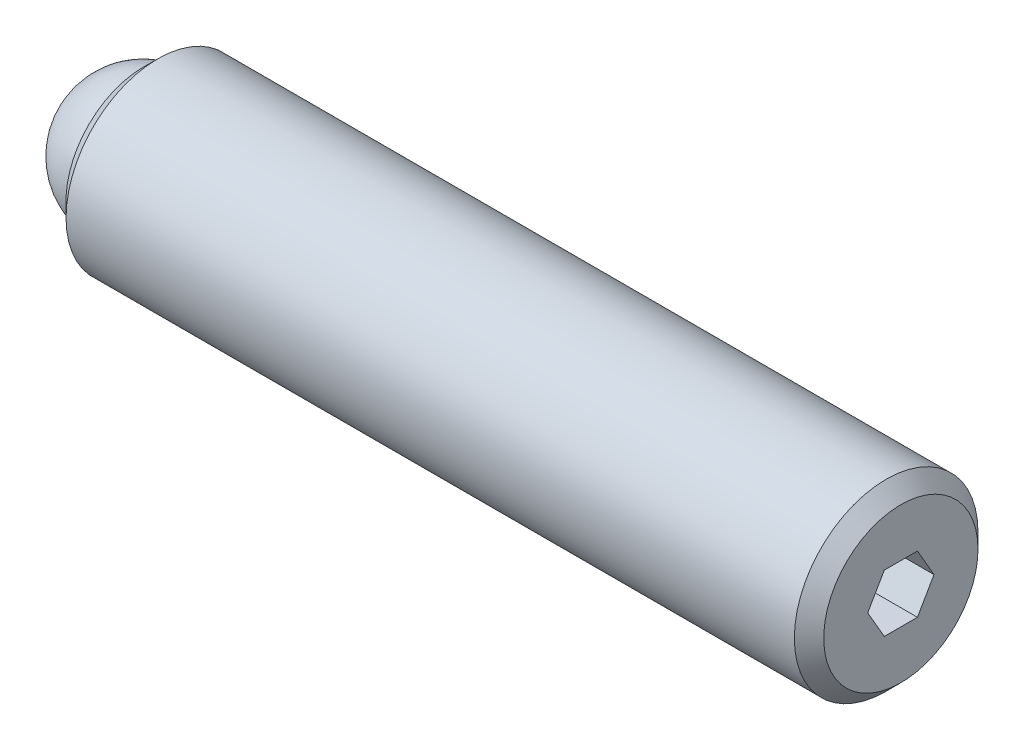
SolidWorks part; units mm, degrees
ref_plane "Front Plane" through (0, 0, 0) normal (0, 0, 1) x (1, 0, 0)
ref_plane "Top Plane" through (0, 0, 0) normal (0, 1, 0) x (1, 0, 0)
ref_plane "Right Plane" through (0, 0, 0) normal (1, 0, 0) x (0, 0, -1)
sketch "Sketch2" plane through (0, 0, 0) normal (1, 0, 0) x (0, 0, -1)
  circle A0 centre (0, 0) radius 3.175
  dimension "D1" = 6.35
extrude "Boss-Extrude1" add sketch "Sketch2" along normal blind 26.1937
sketch "Sketch3" plane through (0, 0, 0) normal (-1, 0, 0) x (0, 0, 1)
  circle A0 centre (0, 0) radius 2.3813
  dimension "D1" = 4.7625
chamfer "Chamfer1" distance 0.508 angle 45 1 edges at (0, 0, -3.175)
chamfer "Chamfer2" distance 0.508 angle 45 1 edges at (26.1937, 0, -3.175)
sketch "Sketch4" plane through (26.1937, 0, 0) normal (1, 0, 0) x (0, 0, -1)
  line L1 (1.1457, 0) -> (0.5728, 0.9922)
  line L2 (0.5728, 0.9922) -> (-0.5728, 0.9922)
  line L3 (-0.5728, 0.9922) -> (-1.1457, 0)
  line L4 (-1.1457, 0) -> (-0.5728, -0.9922)
  line L5 (-0.5728, -0.9922) -> (0.5728, -0.9922)
  line L6 (0.5728, -0.9922) -> (1.1457, 0)
  circle A0 centre (0, 0) radius 0.9922 construction
  dimension "D1" = 1.9844
extrude "Cut-Extrude2" cut sketch "Sketch4" against normal blind 2.286
extrude "Cut-Extrude3" cut sketch "Sketch3" against normal blind 1.9844
sketch "Sketch5" plane through (0, 0, 0) normal (-1, 0, 0) x (0, 0, 1)
  line L0 (0, 0) -> (0, -2.3813)
  line L1 (0, 0) -> (0, 2.3813)
  arc A0 (0, 2.3813) -> (0, -2.3813) centre (0, 0) ccw
  dimension "D1" = 2.3813
revolve "Revolve1" add sketch "Sketch5" angle 360 about L1
